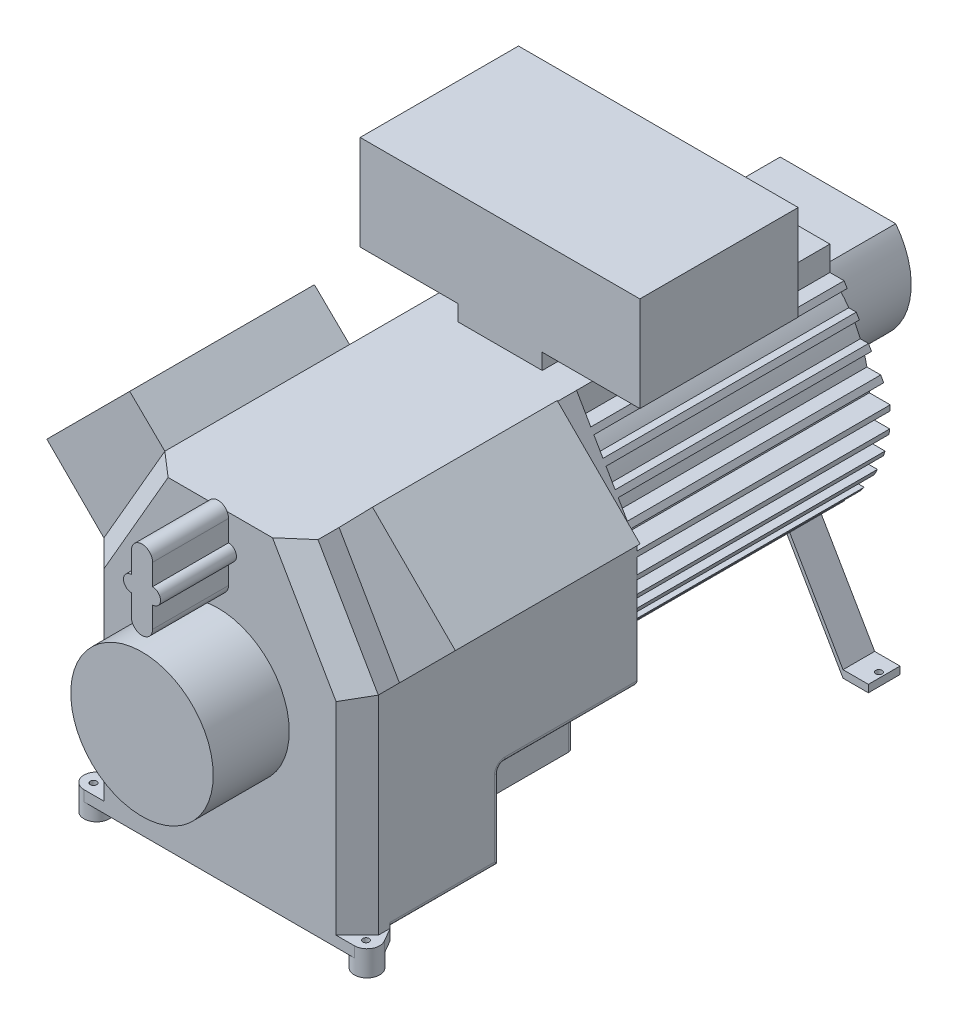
SolidWorks part; units mm, degrees
ref_plane "Alzado" through (0, 0, 0) normal (0, 0, 1) x (1, 0, 0)
ref_plane "Planta" through (0, 0, 0) normal (0, 1, 0) x (1, 0, 0)
ref_plane "Vista lateral" through (0, 0, 0) normal (1, 0, 0) x (0, 0, -1)
sketch "Croquis1" plane through (0, 0, 0) normal (0, 0, 1) x (1, 0, 0)
  line L0 (-57.754, -100.0329) -> (-57.754, -296)
  line L1 (-57.754, -296) -> (202.246, -296)
  line L2 (202.246, -296) -> (202.246, -98.9866)
  line L9 (0, 0) -> (145.0961, 0)
  line L10 (0, 0) -> (-57.754, -100.0329)
  line L11 (145.0961, 0) -> (202.246, -98.9866)
  dimension "D1" = 150
  dimension "D2" = 150
  dimension "D6" = 260
  dimension "D7" = 296
  dimension "D9" = 195.9671
extrude "Saliente-Extruir1" add sketch "Croquis1" along normal blind 265
ref_plane "Plano1" through (0, 0, 245) normal (0, 0, 1) x (1, 0, 0)
sketch "Croquis2" plane through (0, 0, 245) normal (0, 0, 1) x (1, 0, 0)
  line L0 (0, 0) -> (-57.754, -100.0329)
  line L1 (-57.754, -100.0329) -> (-111.7869, -46)
  line L2 (-111.7869, -46) -> (-33.298, 32.4889)
  line L3 (-33.298, 32.4889) -> (0, 0)
  line L4 (-57.754, -100.0329) -> (-57.754, -296) construction
  dimension "D1" = 111
  dimension "D2" = 135
  dimension "D3" = 250
  dimension "D4" = 90
extrude "Saliente-Extruir2" add sketch "Croquis2" against normal blind 175
ref_plane "Plano2" through (0, 0, 225) normal (0, 0, 1) x (1, 0, 0)
sketch "Croquis4" plane through (0, 0, 225) normal (0, 0, 1) x (1, 0, 0)
  line L0 (202.246, -98.9866) -> (255.2326, -46)
  line L1 (255.2326, -46) -> (176.7437, 32.4889)
  line L2 (176.7437, 32.4889) -> (145.0961, 0)
  line L3 (145.0961, 0) -> (202.246, -98.9866)
  line L4 (202.246, -296) -> (202.246, -98.9866) construction
  line L5 (145.0961, 0) -> (145.98, 0.2798)
  dimension "D1" = 250
  dimension "D2" = 135
  dimension "D3" = 111
  dimension "D4" = 90
extrude "Saliente-Extruir3" add sketch "Croquis4" against normal blind 175 contours L3 L0 L1 L2
sketch "Croquis5" plane through (0, 0, 265) normal (0, 0, 1) x (1, 0, 0)
  line L0 (-57.754, -296) -> (202.246, -296) construction
  circle A0 centre (70.3533, -151) radius 67.5
  dimension "D1" = 135
  dimension "D2" = 145
extrude "Saliente-Extruir4" add sketch "Croquis5" along normal blind 72
sketch "Croquis7" plane through (0, 0, 265) normal (0, 0, 1) x (1, 0, 0)
  line L0 (70.3533, -190) -> (70.3533, 45.4015) construction
  line L1 (60.3533, -60) -> (60.3533, -40)
  line L2 (80.3533, -5) -> (80.3533, -25)
  line L3 (60.3533, -25) -> (60.3533, -5)
  line L4 (80.3533, -40) -> (80.3533, -60)
  line L5 (145.0961, 0) -> (0, 0) construction
  arc A0 (60.3533, -60) -> (80.3533, -60) centre (70.3533, -60) ccw
  arc A1 (80.3533, -5) -> (60.3533, -5) centre (70.3533, -5) ccw
  arc A2 (80.3533, -40) -> (80.3533, -25) centre (80.3533, -32.5) ccw
  arc A3 (60.3533, -25) -> (60.3533, -40) centre (60.3533, -32.5) ccw
  dimension "D2" = 20
  dimension "D4" = 20
  dimension "D5" = 15
  dimension "D6" = 15
  dimension "D1" = 130
  dimension "D3" = 55
  dimension "D7" = 5
extrude "Saliente-Extruir5" add sketch "Croquis7" along normal blind 72
sketch "Croquis8" plane through (0, 0, 0) normal (0, 0, -1) x (-1, 0, 0)
  line L0 (57.754, -296) -> (-202.246, -296) construction
  line L1 (57.754, -100.0329) -> (57.754, -296) construction
  line L2 (-145.0961, 0) -> (-145.0961, -23.3152)
  line L3 (0, 0) -> (0, -23.3152)
  line L4 (0, 0) -> (-145.0961, 0)
  line L5 (14.2107, -203.3152) -> (-21.2669, -203.3152)
  line L6 (0.4192, -188.3152) -> (28.5536, -188.3152)
  line L7 (18.0986, -168.3152) -> (41.969, -168.3152)
  line L8 (28.9873, -148.3152) -> (50.7676, -148.3152)
  line L9 (35.1647, -128.3152) -> (55.9018, -128.3152)
  line L10 (8.2538, -208.3152) -> (-32.1549, -208.3152)
  line L11 (32.4267, -183.3152) -> (5.6975, -183.3152)
  line L12 (44.5515, -163.3152) -> (21.34, -163.3152)
  line L13 (52.3716, -143.3152) -> (30.9294, -143.3152)
  line L14 (36.0806, -123.3152) -> (56.6708, -123.3152)
  line L15 (37.4276, -108.3152) -> (57.8052, -108.3152)
  line L16 (37.4192, -103.3152) -> (57.7981, -103.3152)
  line L17 (36.021, -88.3152) -> (56.6207, -88.3152)
  line L18 (35.0875, -83.3152) -> (55.837, -83.3152)
  line L19 (52.2605, -68.3152) -> (30.7953, -68.3152)
  line L20 (50.6402, -63.3152) -> (28.8325, -63.3152)
  line L21 (21.1134, -48.3152) -> (44.3698, -48.3152)
  line L22 (17.8434, -43.3152) -> (41.767, -43.3152)
  line L23 (0, -23.3152) -> (28.2515, -23.3152)
  line L24 (32.1534, -28.3152) -> (5.3305, -28.3152)
  line L25 (-145.0961, -23.3152) -> (-173.3476, -23.3152)
  line L26 (-150.4266, -28.3152) -> (-177.2495, -28.3152)
  line L27 (-162.9395, -43.3152) -> (-186.8631, -43.3152)
  line L28 (-166.2094, -48.3152) -> (-189.4659, -48.3152)
  line L29 (-173.9285, -63.3152) -> (-195.7362, -63.3152)
  line L30 (-197.3566, -68.3152) -> (-175.8914, -68.3152)
  line L31 (-180.1835, -83.3152) -> (-200.9331, -83.3152)
  line L32 (-181.1171, -88.3152) -> (-201.7168, -88.3152)
  line L33 (-182.5153, -103.3152) -> (-202.8942, -103.3152)
  line L34 (-182.5237, -108.3152) -> (-202.9013, -108.3152)
  line L35 (-181.1767, -123.3152) -> (-201.7669, -123.3152)
  line L36 (-180.2608, -128.3152) -> (-200.9979, -128.3152)
  line L37 (-175.8914, -143.6848) -> (-197.3566, -143.6848)
  line L38 (-174.0834, -148.3152) -> (-195.8637, -148.3152)
  line L39 (-123.8292, -203.3152) -> (-159.3068, -203.3152)
  line L40 (-112.9412, -208.3152) -> (-153.3499, -208.3152)
  line L41 (-145.5152, -188.3152) -> (-173.6497, -188.3152)
  line L42 (-150.7936, -183.3152) -> (-177.5228, -183.3152)
  line L43 (-163.1947, -168.3152) -> (-187.0651, -168.3152)
  line L44 (-167.0112, -162.3623) -> (-190.1092, -162.3623)
  arc A0 (-150.4266, -28.3152) -> (-162.9395, -43.3152) centre (-72.548, -106) ccw
  arc A1 (32.1534, -28.3152) -> (28.2515, -23.3152) centre (-72.548, -106) ccw
  arc A2 (17.8434, -43.3152) -> (5.3305, -28.3152) centre (-72.548, -106) ccw
  arc A3 (44.3698, -48.3152) -> (41.767, -43.3152) centre (-72.548, -106) ccw
  arc A4 (28.8325, -63.3152) -> (21.1134, -48.3152) centre (-72.548, -106) ccw
  arc A5 (35.0875, -83.3152) -> (30.7953, -68.3152) centre (-72.548, -106) ccw
  arc A6 (37.4192, -103.3152) -> (36.021, -88.3152) centre (-72.548, -106) ccw
  arc A7 (36.0806, -123.3152) -> (37.4276, -108.3152) centre (-72.548, -106) ccw
  arc A8 (30.9294, -143.3152) -> (35.1647, -128.3152) centre (-72.548, -106) ccw
  arc A9 (21.34, -163.3152) -> (28.9873, -148.3152) centre (-72.548, -106) ccw
  arc A10 (5.6975, -183.3152) -> (18.0986, -168.3152) centre (-72.548, -106) ccw
  arc A11 (-21.2669, -203.3152) -> (0.4192, -188.3152) centre (-72.548, -106) ccw
  arc A12 (28.5536, -188.3152) -> (32.4267, -183.3152) centre (-72.548, -106) ccw
  arc A13 (41.969, -168.3152) -> (44.5515, -163.3152) centre (-72.548, -106) ccw
  arc A14 (50.7676, -148.3152) -> (52.3716, -143.3152) centre (-72.548, -106) ccw
  arc A15 (55.9018, -128.3152) -> (56.6708, -123.3152) centre (-72.548, -106) ccw
  arc A16 (57.8052, -108.3152) -> (57.7981, -103.3152) centre (-72.548, -106) ccw
  arc A17 (56.6207, -88.3152) -> (55.837, -83.3152) centre (-72.548, -106) ccw
  arc A18 (52.2605, -68.3152) -> (50.6402, -63.3152) centre (-72.548, -106) ccw
  arc A19 (8.2538, -208.3152) -> (14.2107, -203.3152) centre (-72.548, -106) ccw
  arc A20 (-173.3476, -23.3152) -> (-177.2495, -28.3152) centre (-72.548, -106) ccw
  arc A21 (32.1534, -28.3152) -> (28.2515, -23.3152) centre (-72.548, -106) ccw
  arc A22 (44.3698, -48.3152) -> (41.767, -43.3152) centre (-72.548, -106) ccw
  arc A23 (52.2605, -68.3152) -> (50.6402, -63.3152) centre (-72.548, -106) ccw
  arc A24 (56.6207, -88.3152) -> (55.837, -83.3152) centre (-72.548, -106) ccw
  arc A25 (57.8052, -108.3152) -> (57.7981, -103.3152) centre (-72.548, -106) ccw
  arc A26 (55.9018, -128.3152) -> (56.6708, -123.3152) centre (-72.548, -106) ccw
  arc A27 (50.7676, -148.3152) -> (52.3716, -143.3152) centre (-72.548, -106) ccw
  arc A28 (41.969, -168.3152) -> (44.5515, -163.3152) centre (-72.548, -106) ccw
  arc A29 (28.5536, -188.3152) -> (32.4267, -183.3152) centre (-72.548, -106) ccw
  arc A30 (8.2538, -208.3152) -> (14.2107, -203.3152) centre (-72.548, -106) ccw
  arc A31 (-159.3068, -203.3152) -> (-153.3499, -208.3152) centre (-72.548, -106) ccw
  arc A32 (-177.5228, -183.3152) -> (-173.6497, -188.3152) centre (-72.548, -106) ccw
  arc A33 (-190.1092, -162.3623) -> (-187.0651, -168.3152) centre (-72.548, -106) ccw
  arc A34 (-112.9412, -208.3152) -> (-32.1549, -208.3152) centre (-72.548, -106) ccw
  arc A35 (-145.5152, -188.3152) -> (-123.8292, -203.3152) centre (-72.548, -106) ccw
  arc A36 (-163.1947, -168.3152) -> (-150.7936, -183.3152) centre (-72.548, -106) ccw
  arc A37 (-174.0834, -148.3152) -> (-167.0112, -162.3623) centre (-72.548, -106) ccw
  arc A38 (-197.3566, -143.6848) -> (-195.8637, -148.3152) centre (-72.548, -106) ccw
  arc A39 (-180.2608, -128.3152) -> (-175.8914, -143.6848) centre (-72.548, -106) ccw
  arc A40 (-201.7669, -123.3152) -> (-200.9979, -128.3152) centre (-72.548, -106) ccw
  arc A41 (-182.5237, -108.3152) -> (-181.1767, -123.3152) centre (-72.548, -106) ccw
  arc A42 (-202.8942, -103.3152) -> (-202.9013, -108.3152) centre (-72.548, -106) ccw
  arc A43 (-181.1171, -88.3152) -> (-182.5153, -103.3152) centre (-72.548, -106) ccw
  arc A44 (-200.9331, -83.3152) -> (-201.7168, -88.3152) centre (-72.548, -106) ccw
  arc A45 (-195.7362, -63.3152) -> (-197.3566, -68.3152) centre (-72.548, -106) ccw
  arc A46 (-175.8914, -68.3152) -> (-180.1835, -83.3152) centre (-72.548, -106) ccw
  arc A47 (-166.2094, -48.3152) -> (-173.9285, -63.3152) centre (-72.548, -106) ccw
  arc A48 (-186.8631, -43.3152) -> (-189.4659, -48.3152) centre (-72.548, -106) ccw
  dimension "D2" = 220
  dimension "D4" = 260.7476
  dimension "D1" = 190
  dimension "D3" = 130.302
  dimension "D5" = 15
  dimension "D6" = 5
  dimension "D7" = 5
  dimension "D8" = 15
  dimension "D9" = 5
  dimension "D10" = 15
  dimension "D11" = 5
  dimension "D12" = 15
  dimension "D13" = 5
  dimension "D14" = 15
  dimension "D15" = 5
  dimension "D16" = 15
  dimension "D17" = 5
  dimension "D18" = 15
  dimension "D19" = 5
  dimension "D20" = 15
  dimension "D21" = 5
  dimension "D22" = 5
  dimension "D23" = 15
extrude "Saliente-Extruir7" add sketch "Croquis8" along normal blind 240 contours L28 A47 L29 L30 A46 L31 L32 A43 L33 L34 A41 L35 A40 L36 A39 L37 A38 L38 A37 L44 A33 L43 A36 L42 A32 L41 A35 L39 A31 L40 A34 L10 A19 L5 A11 L6 A12 L11 A10 L7 A13 L12 A9 L8 A14 L13 A8 L9 M3 M4
chamfer "Chaflán1" distance 20 angle 45 4 edges at (202.246, -197.4933, 265) (173.671, -49.4933, 265) (-57.754, -198.0164, 265) (-28.877, -50.0164, 265)
ref_plane "Plano3" through (0, 0, 0) normal (0, 0, -1) x (-1, 0, 0)
sketch "Croquis9" plane through (0, 0, 0) normal (0, 0, -1) x (-1, 0, 0)
  line L0 (-72.548, 0) -> (-72.548, 46.5035) construction
  line L2 (0, 0) -> (-145.0961, 0) construction
  line L3 (-112.548, 0) -> (-32.548, 0)
  line L4 (-112.548, 0) -> (-112.548, 15)
  line L5 (-32.548, 0) -> (-32.548, 15)
  line L6 (-112.548, 15) -> (-205.048, 15)
  line L7 (-32.548, 15) -> (59.952, 15)
  line L8 (59.952, 15) -> (59.952, 105)
  line L9 (59.952, 105) -> (-205.048, 105)
  line L10 (-205.048, 105) -> (-205.048, 15)
  dimension "D1" = 80
  dimension "D2" = 40
  dimension "D3" = 15
  dimension "D4" = 15
  dimension "D5" = 92.5
  dimension "D6" = 92.5
  dimension "D7" = 90
extrude "Saliente-Extruir8" add sketch "Croquis9" along normal blind 150
sketch "Croquis11" plane through (0, -296, 0) normal (0, -1, 0) x (1, 0, 0)
  line L0 (199.5365, 265) -> (-56.595, 265)
  line L1 (137.8533, 337) -> (2.8533, 265) construction
  line L2 (2.8533, 337) -> (2.8533, 265) construction
  line L3 (209.9208, 246.9861) -> (202.246, 233.7339)
  line L4 (202.246, 245) -> (202.246, 0) construction
  line L5 (202.246, 233.7339) -> (-57.754, 233.7339)
  line L6 (-57.754, 245) -> (-57.754, 0) construction
  line L7 (-57.754, 233.7339) -> (-66.4248, 246.1171)
  arc A0 (-56.595, 265) -> (-66.4248, 246.1171) centre (-56.595, 253) ccw
  arc A1 (209.9208, 246.9861) -> (199.5365, 265) centre (199.5365, 253) ccw
  point P7 (70.3533, 301)
  dimension "D4" = 24
  dimension "D5" = 24
  dimension "D3" = 305
extrude "Saliente-Extruir9" add sketch "Croquis11" along normal blind 10
sketch "Croquis12" plane through (0, -306, 0) normal (0, -1, 0) x (1, 0, 0)
  line L0 (-68.595, 253) -> (-46.9253, 253) construction
  line L1 (-56.595, 265) -> (-56.595, 248.5717) construction
  line L2 (211.5365, 253) -> (195.158, 253) construction
  line L3 (199.5365, 265) -> (199.5365, 248.5717) construction
  arc A0 (-56.595, 265) -> (-66.4248, 246.1171) centre (-56.595, 253) ccw construction
  arc A1 (209.9208, 246.9861) -> (199.5365, 265) centre (199.5365, 253) ccw construction
  circle A2 centre (-56.595, 253) radius 12
  circle A3 centre (199.5365, 253) radius 12
extrude "Saliente-Extruir10" add sketch "Croquis12" along normal blind 14
sketch "Croquis13" plane through (0, 0, -240) normal (0, 0, -1) x (-1, 0, 0)
  line L0 (-131.4087, -216) -> (-11.5209, -216)
  line L1 (-11.5209, -216) -> (44.595, -313)
  line L2 (44.595, -306) -> (44.595, -320) construction
  line L3 (44.595, -313) -> (68.4161, -313)
  line L4 (68.4161, -313) -> (68.4161, -320)
  line L5 (68.4161, -320) -> (44.595, -320)
  line L6 (44.595, -320) -> (-11.5209, -223)
  line L7 (-11.5209, -223) -> (-131.4087, -223)
  line L8 (-131.4087, -223) -> (-187.5365, -320)
  line L9 (-187.5365, -320) -> (-211.5365, -320)
  line L10 (-211.5365, -320) -> (-211.5365, -313)
  line L11 (-211.5365, -296) -> (-211.5365, -320) construction
  line L12 (-211.5365, -313) -> (-187.5365, -313)
  line L13 (-187.5365, -320) -> (-187.5365, -306) construction
  line L14 (-187.5365, -313) -> (-131.4087, -216)
extrude "Saliente-Extruir11" add sketch "Croquis13" against normal blind 30 separate body
sketch "Croquis15" plane through (202.246, 0, 0) normal (1, 0, 0) x (0, 0, -1)
  line L0 (0, -214.7167) -> (-130, -214.7167)
  line L1 (0, -296) -> (0, -108.3152) construction
  line L2 (-130, -214.7167) -> (-130, -296)
  line L3 (-233.7339, -296) -> (0, -296) construction
  line L4 (-130, -296) -> (0, -296)
  line L5 (0, -296) -> (0, -214.7167)
  dimension "D1" = 130
extrude "Cortar-Extruir1" cut sketch "Croquis15" against normal blind 60
sketch "Croquis16" plane through (-57.754, 0, 0) normal (-1, 0, 0) x (0, 0, 1)
  line L0 (0, -216.1522) -> (130.6095, -216.1522)
  line L1 (0, 243.5371) -> (0, -243.5371) construction
  line L2 (130.6095, -216.1522) -> (130, -296)
  line L3 (130, -296) -> (0, -296)
  line L4 (233.7339, -296) -> (0, -296) construction
  line L5 (0, -296) -> (0, -216.1522)
  dimension "D1" = 130
extrude "Cortar-Extruir2" cut sketch "Croquis16" against normal blind 60
fillet "Redondeo4" radius 5 13 edges at (142.246, -214.7167, 65) (172.246, -214.7167, 130) (142.246, -255.3583, 130) (2.246, -256.0761, 130.3047) (-57.754, -256.0761, 130.3047) (-57.754, -216.1522, 65.3047) (2.246, -256.0761, 0) (-27.754, -216.1522, 0) (172.246, -214.7167, 0) (142.246, -255.3583, 0) (202.246, -296, 181.867) (202.246, -255.3583, 130) (202.246, -214.7167, 65)
sketch "Croquis17" plane through (0, -296, 0) normal (0, 1, 0) x (1, 0, 0)
  line L0 (-68.4161, 210) -> (-68.4161, 240) construction
  line L1 (187.5365, 240) -> (211.5365, 240) construction
  line L2 (-68.4161, 240) -> (-44.595, 240) construction
  line L3 (211.5365, 210) -> (211.5365, 240) construction
  line L4 (-37.754, -265) -> (-56.595, -265) construction
  line L5 (199.5365, -265) -> (182.246, -265) construction
  circle A0 centre (206.5365, 225) radius 3
  circle A1 centre (-63.4161, 225) radius 3
  circle A2 centre (200.5365, -255) radius 3
  circle A3 centre (-57.595, -255) radius 3
  dimension "D1" = 6
  dimension "D2" = 5
  dimension "D3" = 15
  dimension "D4" = 15
  dimension "D5" = 5
  dimension "D6" = 10
  dimension "D7" = 10
  dimension "D8" = 1
  dimension "D9" = 1
extrude "Cortar-Extruir3" cut sketch "Croquis17" against normal blind 60
sketch "Croquis18" plane through (0, 0, -240) normal (0, 0, -1) x (-1, 0, 0)
  line L0 (-127.4281, -32.0876) -> (-18.0331, -32.0876)
  arc A0 (-127.4281, -32.0876) -> (-18.0331, -32.0876) centre (-72.7306, -74.8038) ccw
extrude "Saliente-Extruir12" add sketch "Croquis18" along normal blind 80
